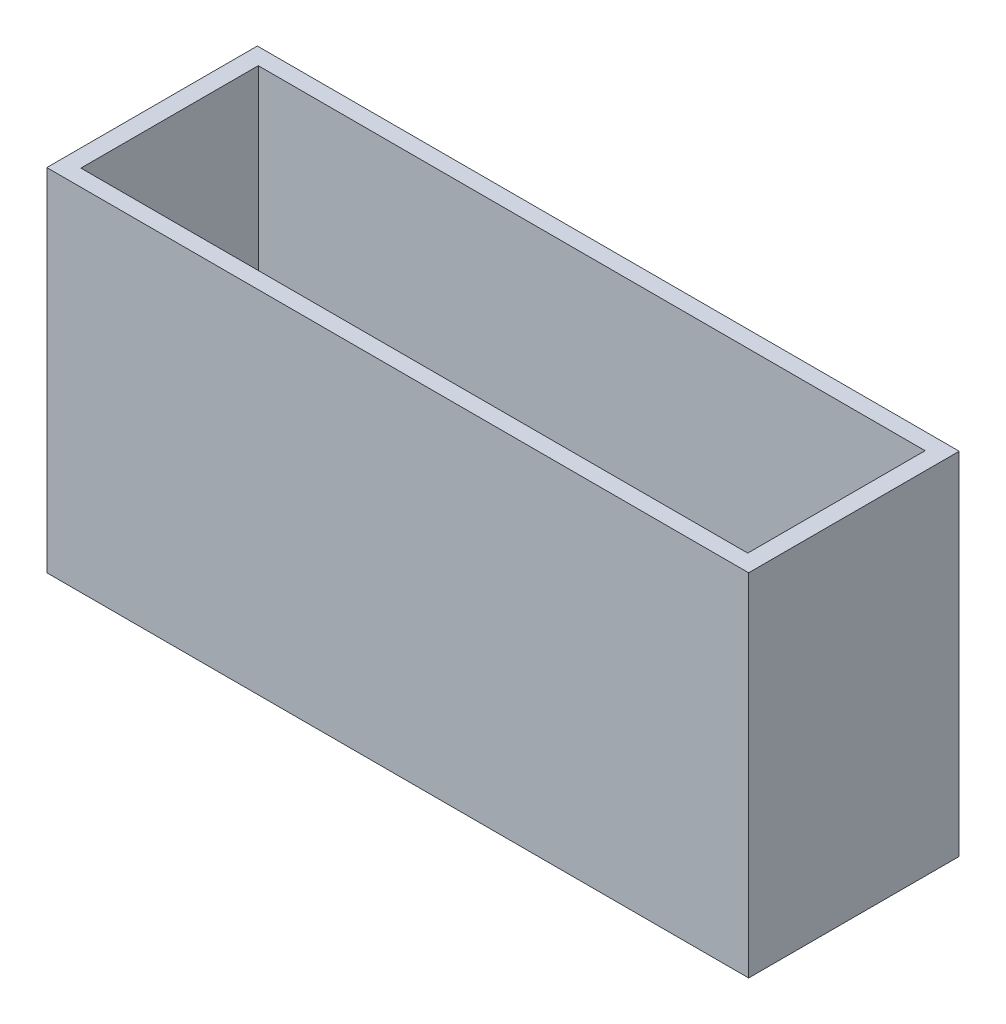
SolidWorks part; units mm, degrees
ref_plane "Front Plane" through (0, 0, 0) normal (0, 0, 1) x (1, 0, 0)
ref_plane "Top Plane" through (0, 0, 0) normal (0, 1, 0) x (1, 0, 0)
ref_plane "Right Plane" through (0, 0, 0) normal (1, 0, 0) x (0, 0, -1)
sketch "Sketch1" plane through (0, 0, 0) normal (0, 1, 0) x (1, 0, 0)
  line L0 (0, 300) -> (1000, 0) construction
  line L1 (0, 0) -> (1000, 0)
  line L2 (0, 0) -> (0, 300)
  line L3 (0, 300) -> (1000, 300)
  line L4 (1000, 0) -> (1000, 300)
  line L5 (1000, 300) -> (0, 0) construction
  line L7 (24.9429, 276.3654) -> (975.0571, 276.3654)
  line L8 (24.9429, 276.3654) -> (24.9429, 23.6346)
  line L9 (24.9429, 23.6346) -> (975.0571, 23.6346)
  line L10 (975.0571, 276.3654) -> (975.0571, 23.6346)
  line L11 (24.9429, 276.3654) -> (975.0571, 23.6346) construction
  line L12 (24.9429, 23.6346) -> (975.0571, 276.3654) construction
  point P5 (500, 150)
  dimension "D1" = 1000
  dimension "D2" = 300
extrude "Boss-Extrude1" add sketch "Sketch1" along normal blind 500
ref_plane "Plane1" through (0, 0, 0) normal (0, 1, 0) x (1, 0, 0)
